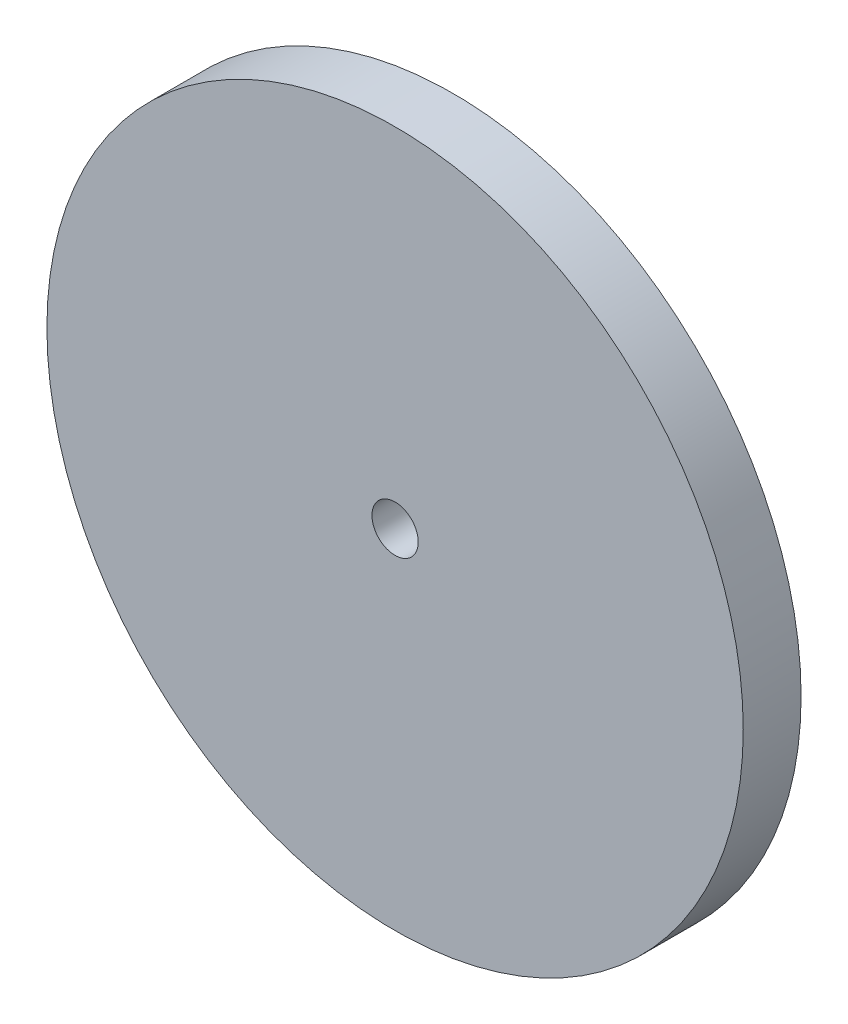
SolidWorks part; units mm, degrees
ref_plane "Front Plane" through (0, 0, 0) normal (0, 0, 1) x (1, 0, 0)
ref_plane "Top Plane" through (0, 0, 0) normal (0, 1, 0) x (1, 0, 0)
ref_plane "Right Plane" through (0, 0, 0) normal (1, 0, 0) x (0, 0, -1)
sketch "Sketch1" plane through (0, 0, 0) normal (0, 0, 1) x (1, 0, 0)
  circle A0 centre (0, 0) radius 60.2
  circle A1 centre (0, 0) radius 4
  dimension "D1" = 120.4
  dimension "D2" = 8
extrude "Boss-Extrude2" add sketch "Sketch1" along normal blind 10
